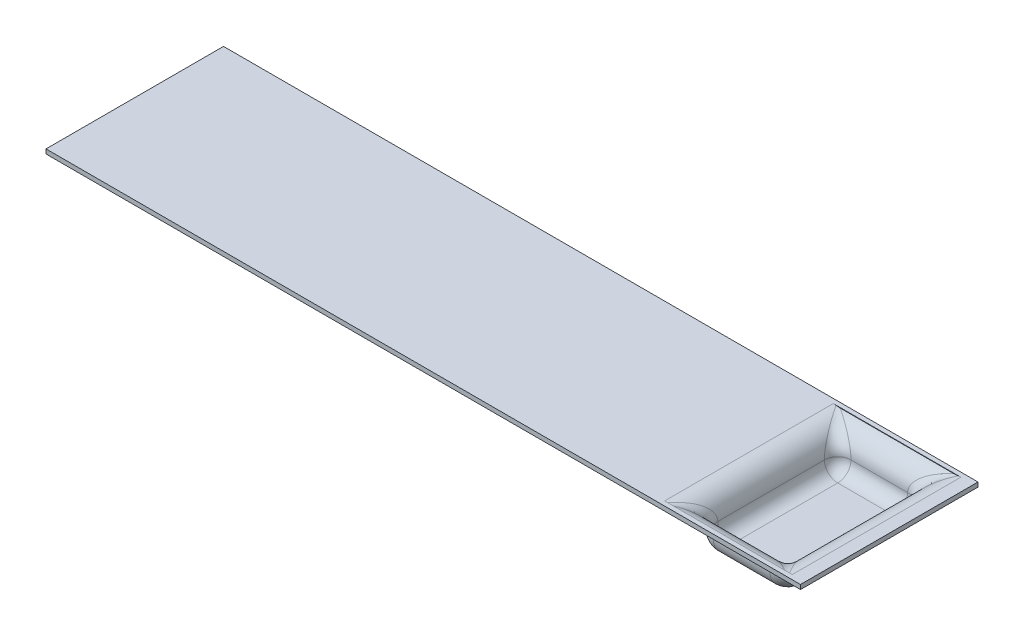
SolidWorks part; units mm, degrees
ref_plane "Front Plane" through (0, 0, 0) normal (0, 0, 1) x (1, 0, 0)
ref_plane "Top Plane" through (0, 0, 0) normal (0, 1, 0) x (1, 0, 0)
ref_plane "Right Plane" through (0, 0, 0) normal (1, 0, 0) x (0, 0, -1)
sketch "Sketch1" plane through (0, 0, 0) normal (0, 0, 1) x (1, 0, 0)
  line L0 (685.6762, 0) -> (700, 0)
  line L1 (0, 0) -> (541.934, 0)
  line L2 (0, 0) -> (0, 5) construction
  line L3 (0, 5) -> (700, 5)
  line L4 (700, 0) -> (700, 5)
  line L6 (0, 0) -> (-150, 0)
  line L7 (645.6762, -40) -> (581.934, -40)
  line L9 (0, 5) -> (-150, 5)
  line L10 (-150, 0) -> (-150, 5)
  arc A0 (581.934, -40) -> (561.934, -20) centre (581.934, -20) cw
  arc A1 (665.6762, -20) -> (645.6762, -40) centre (645.6762, -20) cw
  arc A2 (541.934, 0) -> (561.934, -20) centre (541.934, -20) cw
  arc A3 (685.6762, 0) -> (665.6762, -20) centre (685.6762, -20) ccw
  dimension "D3" = 20
  dimension "D4" = 20
  dimension "D5" = 20
  dimension "D1" = 700
  dimension "D2" = 5
  dimension "D6" = 45
  dimension "D7" = 150
extrude "Extrude1" add sketch "Sketch1" along normal mid plane 200
sketch "Sketch2" plane through (700, 0, 0) normal (1, 0, 0) x (0, 0, -1)
  line L0 (-60, -40) -> (60, -40)
  line L1 (-100, -40) -> (100, -40) construction
  line L2 (100, -20) -> (100, 0) construction
  line L3 (-100, -20) -> (100, -20) construction
  line L4 (0, 0) -> (0, -49.883) construction
  arc A0 (60, -40) -> (80, -20) centre (60, -20) ccw
  arc A1 (80, -20) -> (100, 0) centre (100, -20) cw
  arc A2 (-80, -20) -> (-100, 0) centre (-100, -20) ccw
  arc A3 (-60, -40) -> (-80, -20) centre (-60, -20) cw
  point P22 (0, -40)
  dimension "D1" = 20
extrude "Extrude2" cut sketch "Sketch2" against normal through all and the other way through all
fillet "Fillet1" radius 20 8 edges at (671.5341, -5.8579, 85.8579) (556.0761, -5.8579, 85.8579) (567.7918, -34.1421, -74.1421) (659.8183, -34.1421, -74.1421) (659.8183, -34.1421, 74.1421) (567.7918, -34.1421, 74.1421) (556.0761, -5.8579, -85.8579) (671.5341, -5.8579, -85.8579)
shell "Shell1" thickness 5
